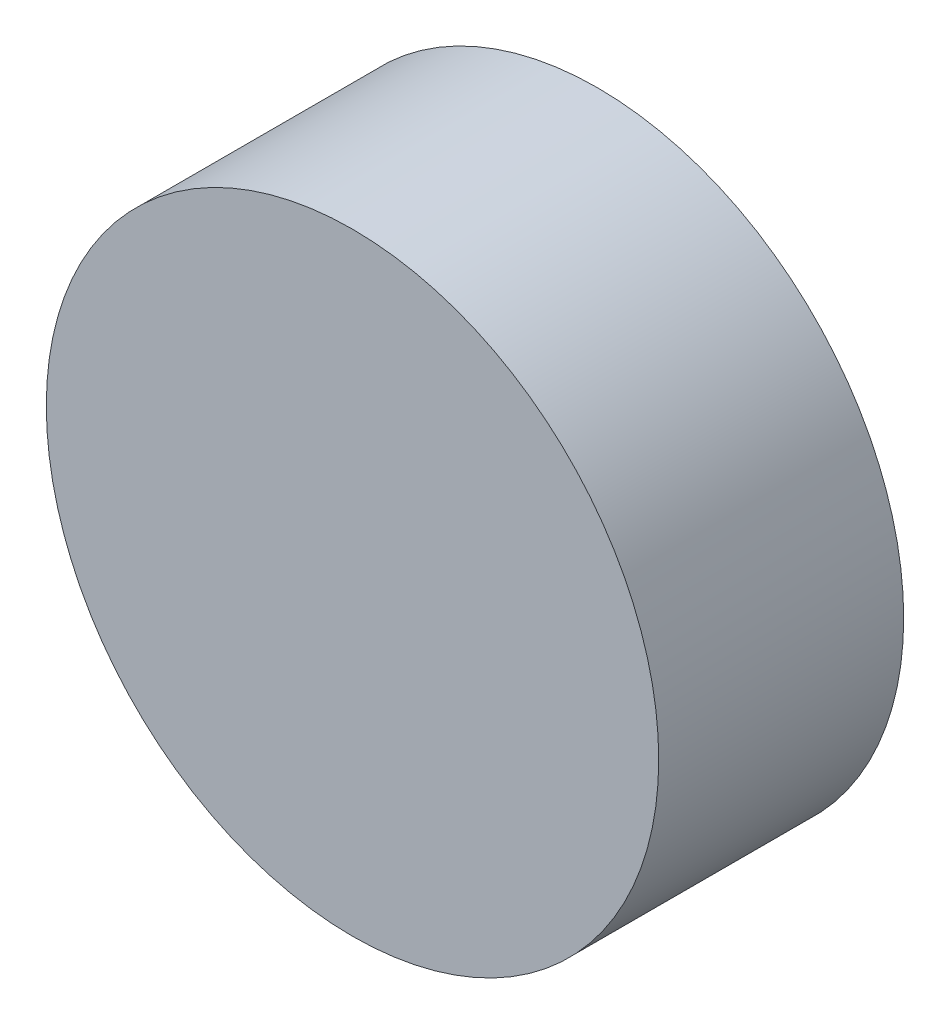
SolidWorks part; units mm, degrees
ref_plane "前视基准面" through (0, 0, 0) normal (0, 0, 1) x (1, 0, 0)
ref_plane "上视基准面" through (0, 0, 0) normal (0, 1, 0) x (1, 0, 0)
ref_plane "右视基准面" through (0, 0, 0) normal (1, 0, 0) x (0, 0, -1)
other "Configuration Table"
sketch "草图1" plane through (0, 0, 0) normal (0, 0, 1) x (1, 0, 0)
  circle A0 centre (0, 0) radius 3.75
  dimension "D1" = 7.5
extrude "Mounting_Screw_Head" add sketch "草图1" against normal mid plane 3
